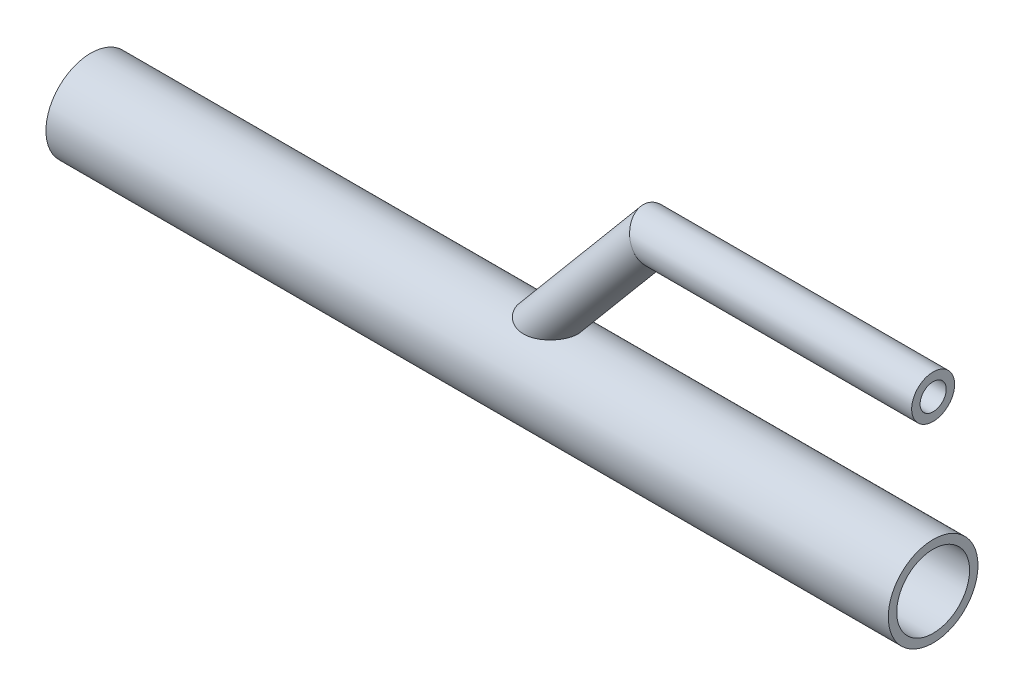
SolidWorks part; units mm, degrees
ref_plane "Ebene vorne" through (0, 0, 0) normal (0, 0, 1) x (1, 0, 0)
ref_plane "Ebene oben" through (0, 0, 0) normal (0, 1, 0) x (1, 0, 0)
ref_plane "Ebene rechts" through (0, 0, 0) normal (1, 0, 0) x (0, 0, -1)
sketch3d "3D-Skizze1"
  line L0 (0, 0, 0) -> (200, 0, 0)
  line L1 (100, 0, 0) -> (133.564, 40, 0)
  line L2 (133.564, 40, 0) -> (200, 40, 0)
  dimension "D1" = 50
  dimension "D2" = 40
  dimension "D3" = 200
  dimension "D4" = 100
other "Strukturbauteil1"
ref_plane "Ebene1" through (0, 0, 0) normal (1, 0, 0) x (0, 0, -1)
sketch "Skizze11" plane through (0, 0, 0) normal (1, 0, 0) x (0, 0, -1)
  circle A0 centre (0, 0) radius 10.65
  circle A1 centre (0, 0) radius 8.65
  point P2 (0, 0)
  point P4 (10.65, 0)
  point P5 (0, -10.65)
  point P6 (-10.65, 0)
  point P7 (0, 10.65)
  point P8 (0, 8.65)
  point P9 (0, -8.65)
  point P10 (-8.65, 0)
  point P11 (8.65, 0)
  point P12 (0, 0)
  dimension "Da" = 21.3
  dimension "s" = 2
other "Strukturbauteil2"
ref_plane "Ebene2" through (100, 0, 0) normal (0.6428, 0.766, 0) x (0.5868, -0.4924, -0.6428)
sketch "Skizze12" plane through (100, 0, 0) normal (0.6428, 0.766, 0) x (0.5868, -0.4924, -0.6428)
  circle A0 centre (0, 0) radius 5.1
  circle A1 centre (0, 0) radius 3.1
  point P2 (0, 0)
  point P4 (5.1, 0)
  point P5 (0, -5.1)
  point P6 (-5.1, 0)
  point P7 (0, 5.1)
  point P8 (0, 3.1)
  point P9 (0, -3.1)
  point P10 (-3.1, 0)
  point P11 (3.1, 0)
  point P12 (0, 0)
  dimension "Da" = 10.2
  dimension "s" = 2
other "Trimmen/Verlängern1"
